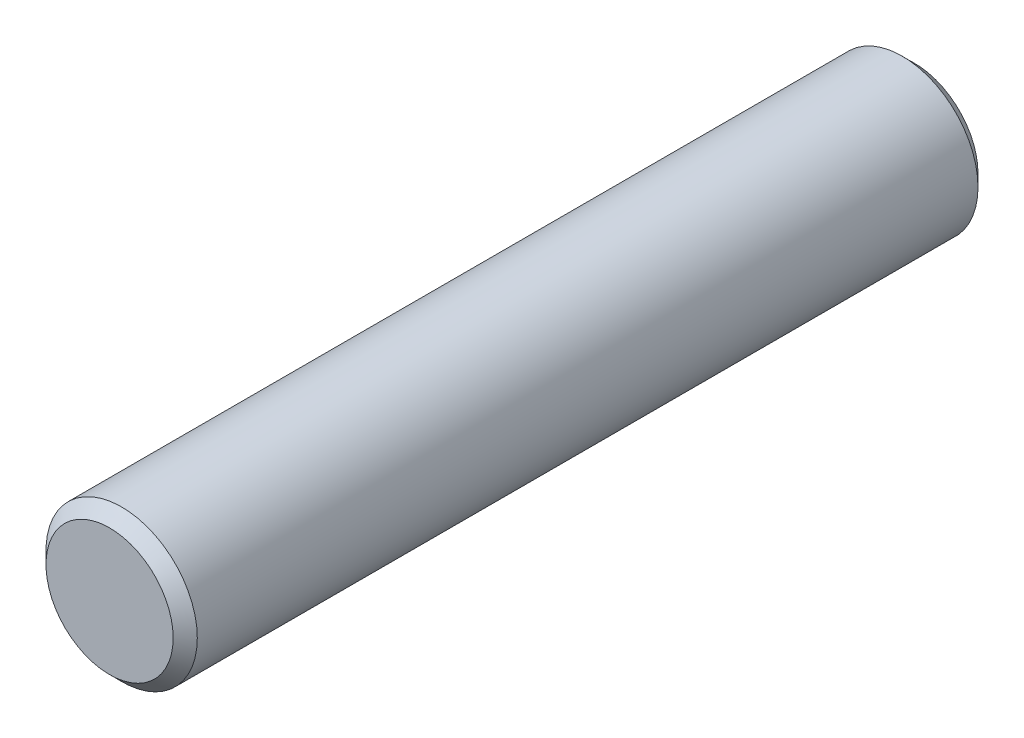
SolidWorks part; units mm, degrees
ref_plane "Front Plane" through (0, 0, 0) normal (0, 0, 1) x (1, 0, 0)
ref_plane "Top Plane" through (0, 0, 0) normal (0, 1, 0) x (1, 0, 0)
ref_plane "Right Plane" through (0, 0, 0) normal (1, 0, 0) x (0, 0, -1)
sketch "Sketch1" plane through (0, 0, 0) normal (0, 0, 1) x (1, 0, 0)
  circle A0 centre (0, 0) radius 2.3876
  dimension "D1" = 4.7752
extrude "Boss-Extrude1" add sketch "Sketch1" along normal mid plane 25.4
chamfer "Chamfer1" distance 0.381 angle 45 2 edges at (2.3876, 0, -12.7) (2.3876, 0, 12.7)
